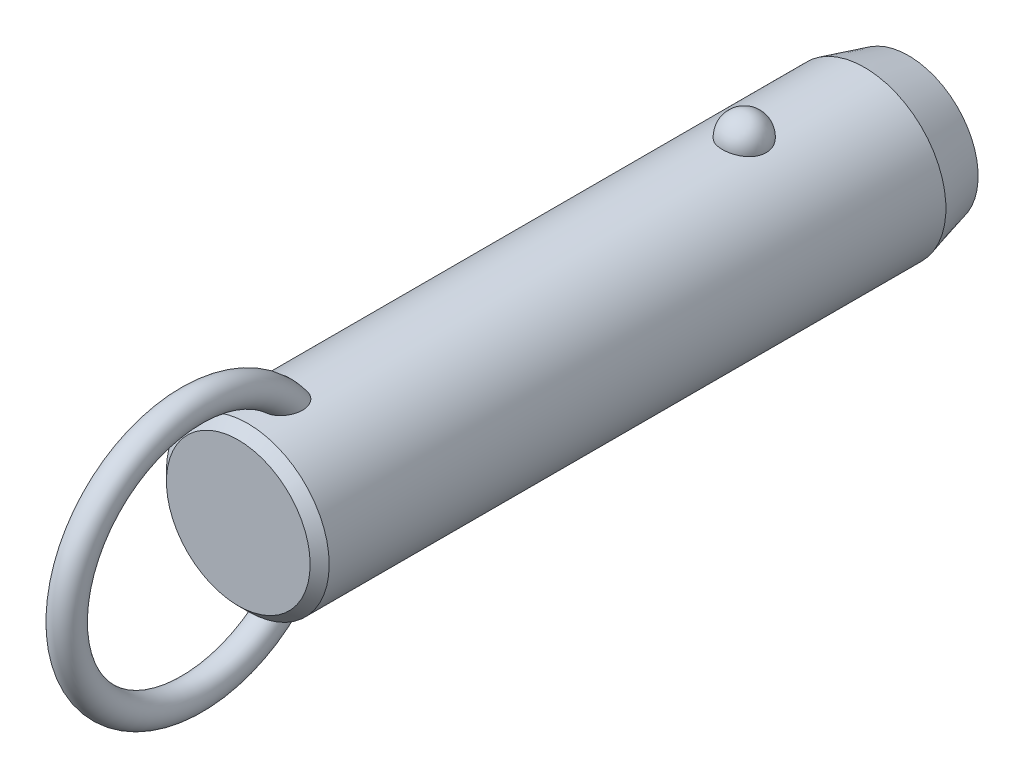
SolidWorks part; units mm, degrees
ref_plane "Front Plane" through (0, 0, 0) normal (0, 0, 1) x (1, 0, 0)
ref_plane "Top Plane" through (0, 0, 0) normal (0, 1, 0) x (1, 0, 0)
ref_plane "Right Plane" through (0, 0, 0) normal (1, 0, 0) x (0, 0, -1)
sketch "Sketch2" plane through (0, 0, 0) normal (0, 0, 1) x (1, 0, 0)
  circle A0 centre (0, 0) radius 11.1
  point P3 (0, 11.1)
  dimension "D1" = 22.2
extrude "Boss-Extrude1" add sketch "Sketch2" along normal blind 53.3
sketch "Sketch3" plane through (0, 0, 0) normal (0, 0, -1) x (-1, 0, 0)
  circle A0 centre (0, 0) radius 11.1
  dimension "D1" = 22.2
extrude "Boss-Extrude2" add sketch "Sketch3" along normal blind 25.4
chamfer "Chamfer1" distance 6 angle 15 1 edges at (-11.1, 0, -25.4)
sketch "Sketch12" plane through (0, 0, 0) normal (1, 0, 0) x (0, 0, -1)
  line L0 (-53.3, 11.1) -> (-53.3, -11.1) construction
  point P0 (-53.3, 0)
sketch "Sketch13" plane through (0, 0, 0) normal (1, 0, 0) x (0, 0, -1)
  circle A0 centre (-72.35, 0) radius 19.05
  point P2 (-53.3, 0)
  dimension "D1" = 38.1
sketch "Sketch14" plane through (0, 0, 0) normal (0, 1, 0) x (1, 0, 0)
  circle A0 centre (0, -55.3) radius 2
  point P2 (0, -53.3)
  dimension "D1" = 4
sweep "Sweep1" add profiles "Sketch14" path "Sketch13"
sketch "Sketch15" plane through (0, 0, 53.3) normal (0, 0, 1) x (1, 0, 0)
  circle A0 centre (0, 0) radius 11.1
  dimension "D1" = 22.2
extrude "Boss-Extrude3" add sketch "Sketch15" along normal blind 12.7
chamfer "Chamfer2" distance 1.3 angle 45 1 edges at (11.1, 0, 66)
sketch "Sketch18" plane through (0, 0, 0) normal (1, 0, 0) x (0, 0, -1)
  line L0 (19.4, 11.1) -> (-56.868, 11.1) construction
  line L1 (3, 14.1) -> (3, 8.1)
  line L2 (-56.868, -11.1) -> (19.4, -11.1) construction
  arc A0 (3, 14.1) -> (3, 8.1) centre (3, 11.1) ccw
  point P4 (0, 11.1)
  dimension "D1" = 25.2
revolve "Revolve1" add sketch "Sketch18" angle 360 about L1
